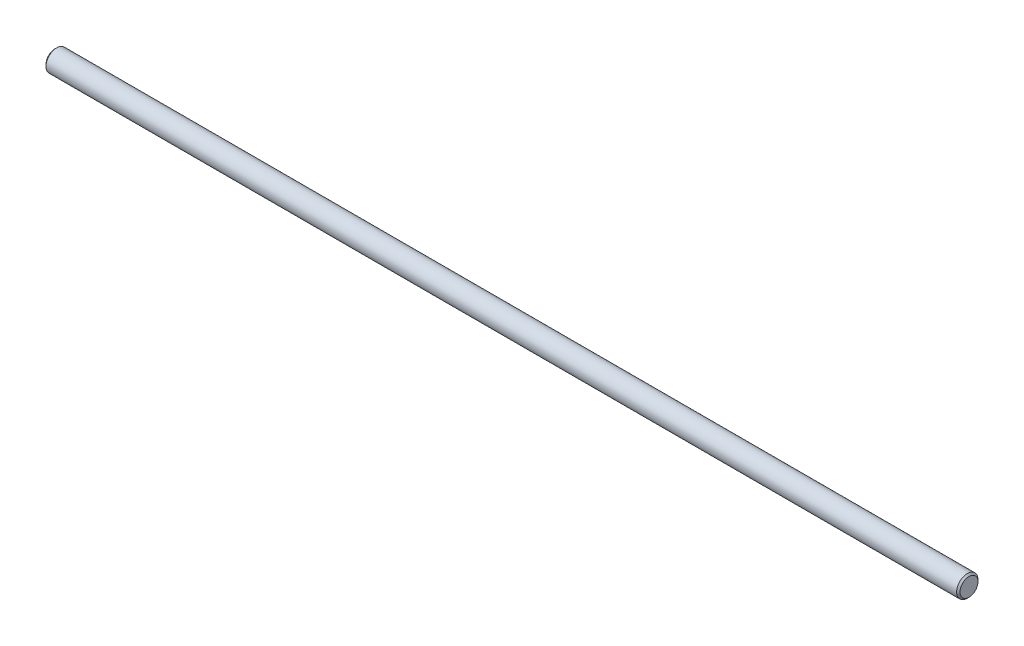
SolidWorks part; units mm, degrees
ref_plane "Front" through (0, 0, 0) normal (0, 0, 1) x (1, 0, 0)
ref_plane "Top" through (0, 0, 0) normal (0, 1, 0) x (1, 0, 0)
ref_plane "Right" through (0, 0, 0) normal (1, 0, 0) x (0, 0, -1)
sketch "Sketch1" plane through (0, 0, 0) normal (1, 0, 0) x (0, 0, -1)
  circle A0 centre (0, 0) radius 2.3812
  dimension "D1" = 4.7625
extrude "Extrude1" add sketch "Sketch1" along normal blind 203.2
chamfer "Chamfer1" distance 0.381 angle 45 2 edges at (0, 0, -2.3812) (203.2, 0, -2.3812)
